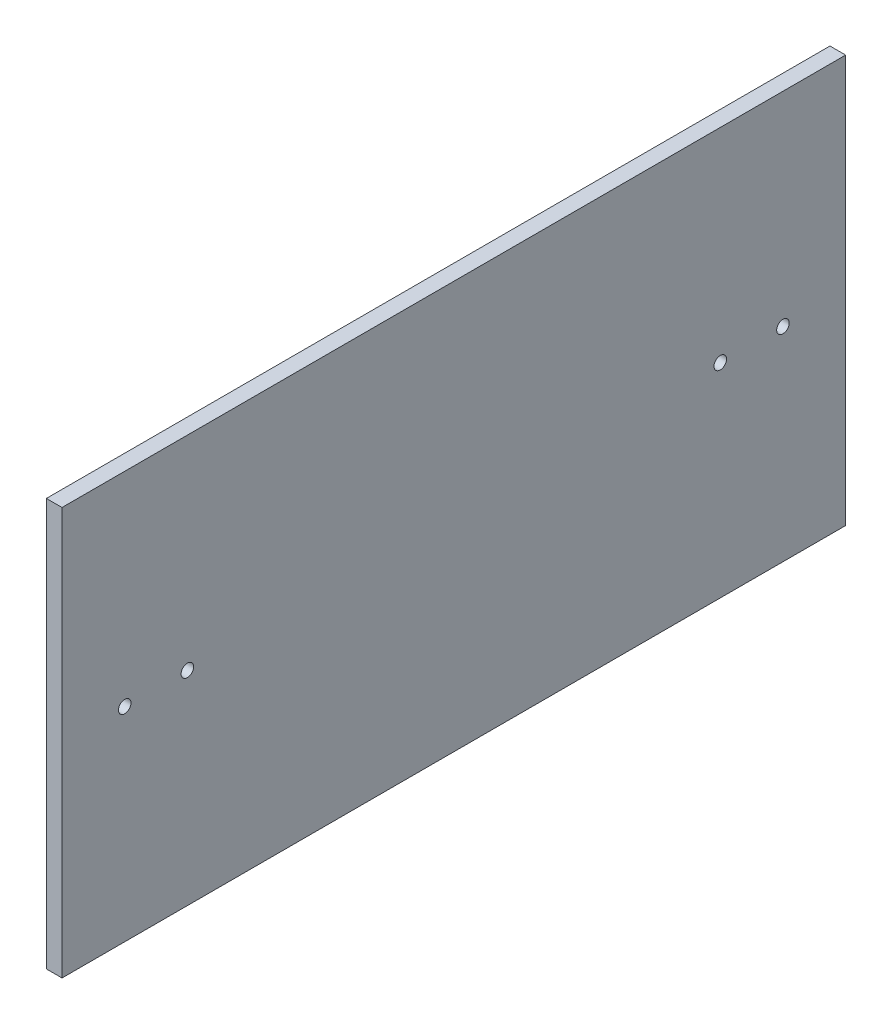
SolidWorks part; units mm, degrees
ref_plane "Front Plane" through (0, 0, 0) normal (0, 0, 1) x (1, 0, 0)
ref_plane "Top Plane" through (0, 0, 0) normal (0, 1, 0) x (1, 0, 0)
ref_plane "Right Plane" through (0, 0, 0) normal (1, 0, 0) x (0, 0, -1)
sketch "Sketch1" plane through (0, 0, 0) normal (1, 0, 0) x (0, 0, -1)
  line L1 (0, 0) -> (317.5, 0)
  line L2 (0, 0) -> (0, 165.1)
  line L3 (0, 165.1) -> (317.5, 165.1)
  line L4 (317.5, 0) -> (317.5, 165.1)
  dimension "D1" = 165.1
  dimension "D2" = 317.5
extrude "Boss-Extrude1" add sketch "Sketch1" along normal blind 6.35
sketch "Sketch2" plane through (6.35, 0, 0) normal (1, 0, 0) x (0, 0, -1)
  line L1 (0, 165.1) -> (0, 0) construction
  line L3 (158.75, 165.1) -> (158.75, 0)
  line L4 (317.5, 165.1) -> (0, 165.1) construction
  line L5 (0, 0) -> (317.5, 0) construction
  circle A0 centre (25.4, 82.55) radius 2.54
  circle A1 centre (50.8, 82.55) radius 2.54
  circle A2 centre (266.7, 82.55) radius 2.54
  circle A3 centre (292.1, 82.55) radius 2.54
  dimension "D1" = 5.08
  dimension "D2" = 25.4
  dimension "D3" = 2
extrude "Cut-Extrude1" cut sketch "Sketch2" against normal blind 12.7 contours A3 | A2 | A1 | A0
